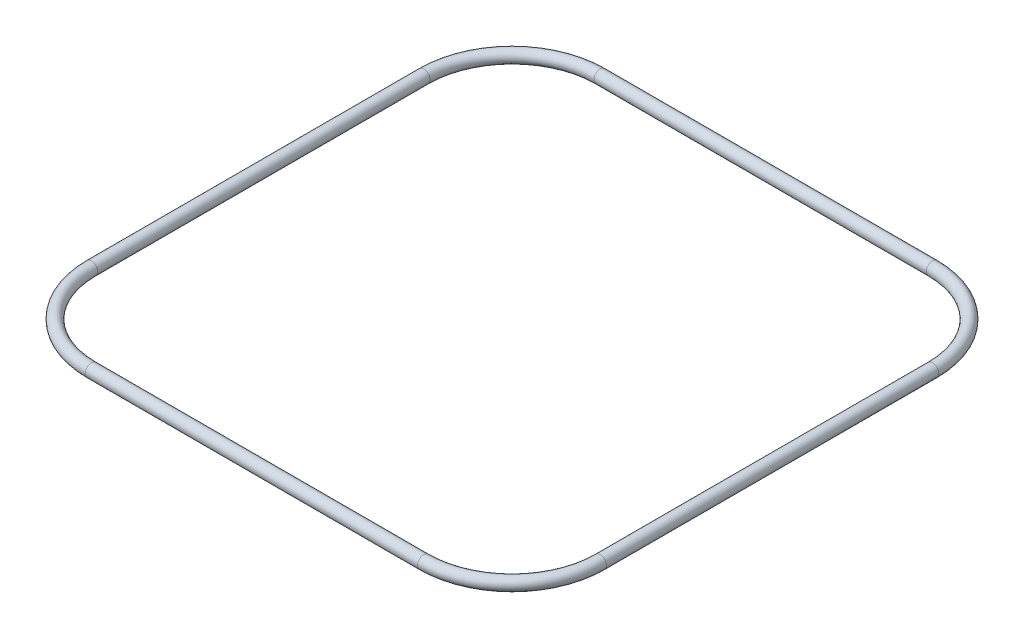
SolidWorks part; units mm, degrees
ref_plane "Front Plane" through (0, 0, 0) normal (0, 0, 1) x (1, 0, 0)
ref_plane "Top Plane" through (0, 0, 0) normal (0, 1, 0) x (1, 0, 0)
ref_plane "Right Plane" through (0, 0, 0) normal (1, 0, 0) x (0, 0, -1)
sketch "path" plane through (0, 0, 0) normal (0, 1, 0) x (1, 0, 0)
  line L1 (-23.4445, 71.778) -> (23.4445, 71.778)
  line L2 (-35.889, 59.3335) -> (-35.889, 12.4445)
  line L3 (-23.4445, 0) -> (23.4445, 0)
  line L4 (35.889, 59.3335) -> (35.889, 12.4445)
  arc A0 (-23.4445, 71.778) -> (-35.889, 59.3335) centre (-23.4445, 59.3335) ccw
  arc A1 (35.889, 59.3335) -> (23.4445, 71.778) centre (23.4445, 59.3335) ccw
  arc A2 (-35.889, 12.4445) -> (-23.4445, 0) centre (-23.4445, 12.4445) ccw
  arc A3 (23.4445, 0) -> (35.889, 12.4445) centre (23.4445, 12.4445) ccw
  dimension "D2" = 24.889
  dimension "D1" = 71.778
  dimension "D3" = 71.778
sketch "profile" plane through (0, 0, 0) normal (1, 0, 0) x (0, 0, -1)
  circle A0 centre (0, 0) radius 0.889
  dimension "D1" = 1.778
sweep "Sweep1" add profiles "profile" path "path"
